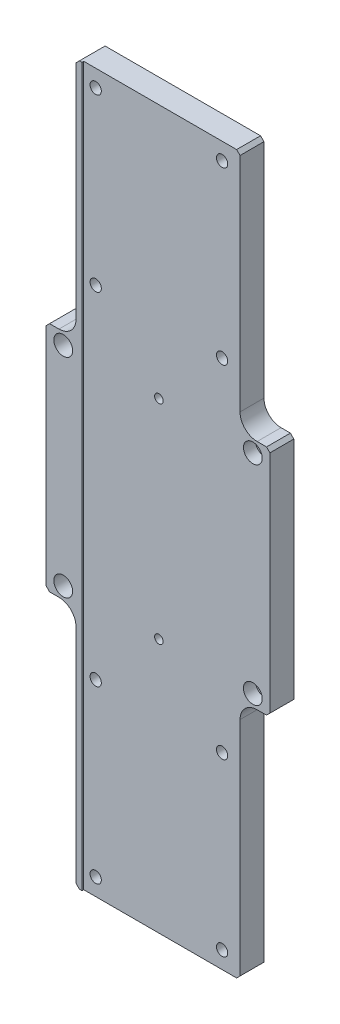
SolidWorks part; units mm, degrees
ref_plane "정면" through (0, 0, 0) normal (0, 0, 1) x (1, 0, 0)
ref_plane "윗면" through (0, 0, 0) normal (0, 1, 0) x (1, 0, 0)
ref_plane "우측면" through (0, 0, 0) normal (1, 0, 0) x (0, 0, -1)
sketch "스케치1" plane through (0, 0, 0) normal (0, 0, 1) x (1, 0, 0)
  line L1 (-65, 68) -> (65, 68)
  line L2 (-65, 68) -> (-65, -68)
  line L3 (-65, -68) -> (65, -68)
  line L4 (65, 68) -> (65, -68)
  line L5 (-47.5, 210) -> (47.5, 210)
  line L6 (-47.5, 210) -> (-47.5, -210)
  line L7 (-47.5, -210) -> (47.5, -210)
  line L8 (47.5, 210) -> (47.5, -210)
  line L9 (-47.5, 210) -> (47.5, -210) construction
  line L10 (-47.5, -210) -> (47.5, 210) construction
  point P5 (0, 0)
  dimension "D1" = 95
  dimension "D2" = 17.5
  dimension "D3" = 17.5
  dimension "D4" = 136
  dimension "D5" = 142
  dimension "D6" = 142
extrude "보스-돌출1" add sketch "스케치1" along normal mid plane 15 contours L5 L8 L7 L6 | L1 L4 L3 L2
sketch "스케치2" plane through (0, 0, 7.5) normal (0, 0, 1) x (1, 0, 0)
  line L0 (-47.5, 210) -> (47.5, 210) construction
  line L1 (-44, 210) -> (65, 210)
  line L2 (-44, 210) -> (-44, -210)
  line L3 (-44, -210) -> (65, -210)
  line L4 (65, 210) -> (65, -210)
  line L5 (65, 68) -> (65, -68) construction
  line L6 (-47.5, -210) -> (47.5, -210) construction
  line L7 (-65, 68) -> (-65, -68) construction
  dimension "D1" = 21
extrude "컷-돌출1" cut sketch "스케치2" against normal blind 1
hole_wizard "M6 소켓 머리 캡 나사용 카운터보어1" positions "스케치5" profile "스케치4" counterbore size "M6" standard "KS"
sketch "스케치5" plane through (0, 0, 7.5) normal (0, 0, 1) x (1, 0, 0)
  line L0 (-65, 68) -> (-65, -68) construction
  line L1 (47.5, 210) -> (-44, 210) construction
  point P0 (-55, 61)
  point P2 (-55, -61)
  point P4 (55, 61)
  point P6 (55, -61)
  dimension "D1" = 110
  dimension "D2" = 10
  dimension "D3" = 122
  dimension "D4" = 149
sketch "스케치4" plane through (-55, 61, 7.5) normal (1, 0, 0) x (0, -1, 0)
  line L0 (0, 0) -> (0, 15)
  line L1 (0, 15) -> (3.3, 15)
  line L3 (3.3, 15) -> (3.3, 8)
  line L4 (3.3, 8) -> (5.5, 8)
  line L5 (5.5, 8) -> (5.5, 0)
  line L7 (5.5, 0) -> (0, 0)
  line L11 (0, -6.35) -> (0, 107.95) construction
  dimension "관통 구멍 지름" = 6.6
  dimension "관통 구멍 깊이" = 15
  dimension "카운터보어 지름" = 11
  dimension "카운터보어 깊이" = 8
hole_wizard "M6 소켓 머리 캡 나사용 카운터보어2" positions "스케치6" profile "스케치7" counterbore size "M6" standard "KS"
sketch "스케치6" plane through (0, 0, -7.5) normal (0, 0, -1) x (-1, 0, 0)
  line L0 (47.5, 210) -> (-47.5, 210) construction
  line L1 (-47.5, 210) -> (-47.5, 68) construction
  point P0 (-37, 200)
  point P2 (37, 200)
  point P4 (-37, 100)
  point P6 (37, 100)
  dimension "D1" = 100
  dimension "D2" = 10
  dimension "D3" = 10.5
  dimension "D4" = 74
sketch "스케치7" plane through (37, 200, -7.5) normal (1, 0, 0) x (0, 1, 0)
  line L0 (0, 0) -> (0, 15)
  line L1 (0, 15) -> (3.3, 15)
  line L3 (3.3, 15) -> (3.3, 8)
  line L4 (3.3, 8) -> (5.5, 8)
  line L5 (5.5, 8) -> (5.5, 0)
  line L7 (5.5, 0) -> (0, 0)
  line L11 (0, -6.35) -> (0, 107.95) construction
  dimension "관통 구멍 지름" = 6.6
  dimension "관통 구멍 깊이" = 15
  dimension "카운터보어 지름" = 11
  dimension "카운터보어 깊이" = 8
pattern_linear "선형 패턴1" count 2 spacing 300 along (0, -1, 0) of "M6 소켓 머리 캡 나사용 카운터보어2"
hole_wizard "Ø5.0mm 맞춤핀 구멍1" positions "스케치8" profile "스케치9" hole size "Ø5.0" standard "ISO"
sketch "스케치8" plane through (0, 0, 6.5) normal (0, 0, 1) x (1, 0, 0)
  line L0 (0, 0) -> (0, 222.2647) construction
  line L1 (47.5, 210) -> (-44, 210) construction
  point P6 (0, 61)
  point P8 (0, -61)
  dimension "D1" = 122
  dimension "D2" = 149
sketch "스케치9" plane through (0, -61, 6.5) normal (1, 0, 0) x (0, -1, 0)
  line L0 (0, 0) -> (0, 14)
  line L1 (0, 14) -> (2.5, 14)
  line L2 (2.5, 14) -> (2.5, 0)
  line L5 (2.5, 0) -> (0, 0)
  line L11 (0, -6.35) -> (0, 107.95) construction
  dimension "관통 구멍 지름" = 5
  dimension "관통 구멍 깊이" = 14
fillet "필렛1" radius 10 4 edges at (47.5, -68, -0.5) (-47.5, -68, 0) (-47.5, 68, 0) (47.5, 68, -0.5)
chamfer "모따기1" distance 2 angle 45 8 edges at (65, 68, -0.5) (47.5, 210, -0.5) (-47.5, 210, 0) (-65, 68, 0) (-65, -68, 0) (-47.5, -210, 0) (65, -68, -0.5) (47.5, -210, -0.5)
